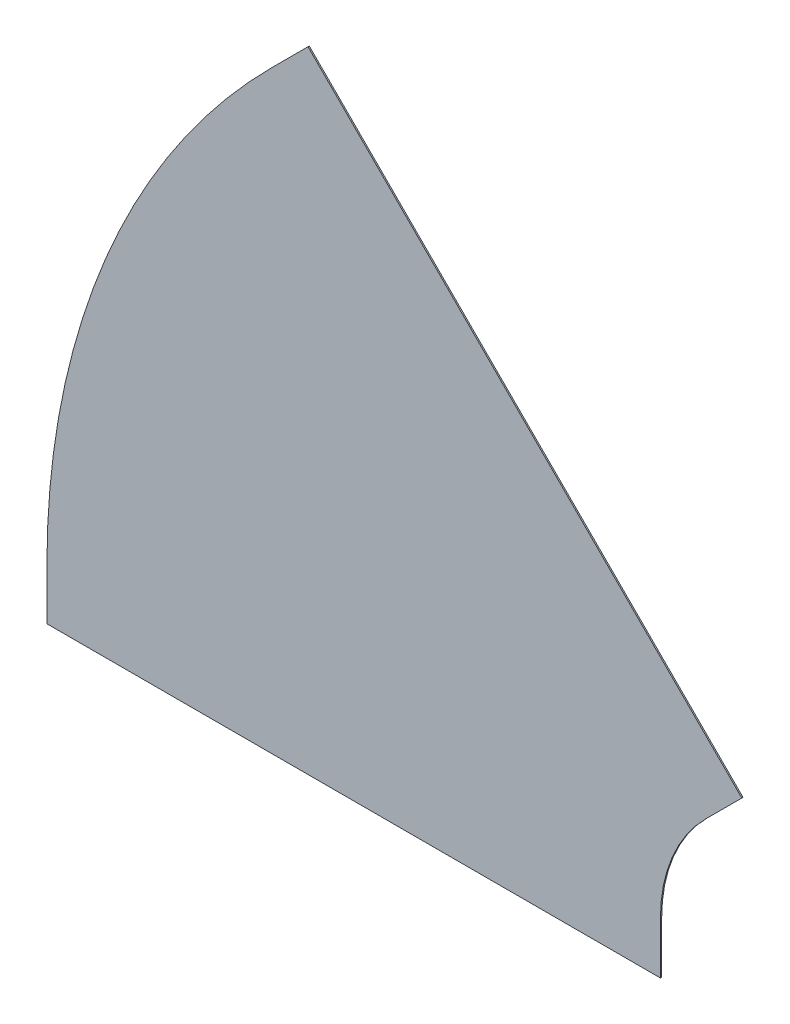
SolidWorks part; units mm, degrees
ref_plane "Front Plane" through (0, 0, 0) normal (0, 0, 1) x (1, 0, 0)
ref_plane "Top Plane" through (0, 0, 0) normal (0, 1, 0) x (1, 0, 0)
ref_plane "Right Plane" through (0, 0, 0) normal (1, 0, 0) x (0, 0, -1)
sketch "Sketch1" plane through (0, 0, 0) normal (0, 0, 1) x (1, 0, 0)
  line L0 (0, 0) -> (597.572, 0)
  line L1 (597.572, 0) -> (597.572, 50)
  line L2 (641.506, 156.066) -> (676.8613, 191.4214)
  line L3 (676.8613, 191.4214) -> (254.3141, 613.9686)
  line L4 (254.3141, 613.9686) -> (218.9588, 578.6132)
  line L5 (0, 50) -> (0, 0)
  arc A0 (597.572, 50) -> (641.506, 156.066) centre (747.572, 50) cw
  arc A1 (218.9588, 578.6132) -> (0, 50) centre (747.572, 50) ccw
  dimension "D3" = 150
  dimension "D1" = 50
  dimension "D2" = 45
  dimension "D4" = 597.572
sheet metal parameters "Sheet-Metal1" thickness 1.2141 parameters "D1"=1.27
base flange "Base-Flange1" sketch "Sketch1" thickness 1.2141 reverse thickness direction yes parameters "D1"=1.27
flat pattern "Flat-Pattern1"
sketch "Bend-Lines1" plane through (0, 0, 0) normal (0, 1, 0) x (-1, 0, 0)
